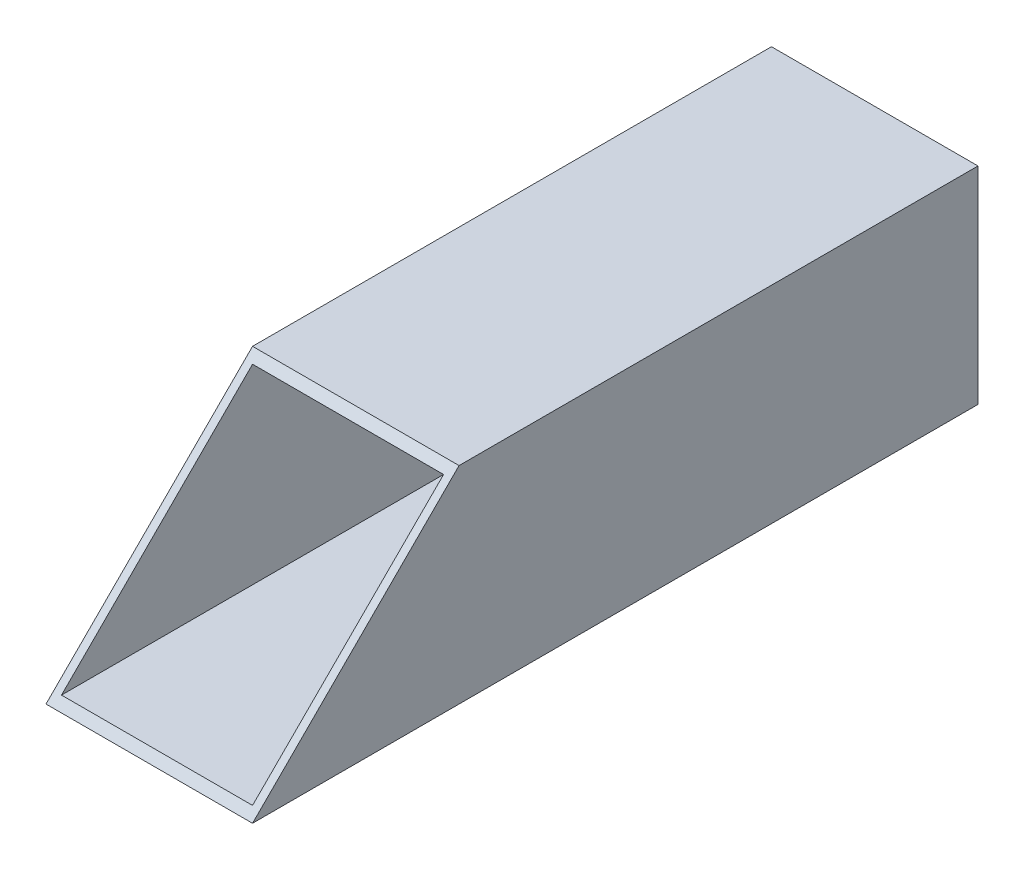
SolidWorks part; units mm, degrees
ref_plane "Plan de face" through (0, 0, 0) normal (0, 0, 1) x (1, 0, 0)
ref_plane "Plan de dessus" through (0, 0, 0) normal (0, 1, 0) x (1, 0, 0)
ref_plane "Plan de droite" through (0, 0, 0) normal (1, 0, 0) x (0, 0, -1)
sketch "Esquisse1" plane through (0, 0, 0) normal (0, 0, 1) x (1, 0, 0)
  line L1 (0, 80) -> (80, 80)
  line L2 (0, 80) -> (0, 0)
  line L3 (0, 0) -> (80, 0)
  line L4 (80, 80) -> (80, 0)
  line L5 (3, 77) -> (77, 77)
  line L6 (3, 77) -> (3, 3)
  line L7 (3, 3) -> (77, 3)
  line L8 (77, 77) -> (77, 3)
  dimension "D1" = 80
  dimension "D2" = 80
  dimension "D3" = 3
  dimension "D4" = 3
  dimension "D5" = 3
  dimension "D6" = 3
extrude "Extrusion1" add sketch "Esquisse1" along normal blind 281
chamfer "Chanfrein1" distance 80 distance2 80 1 edges at (40, 80, 281)
